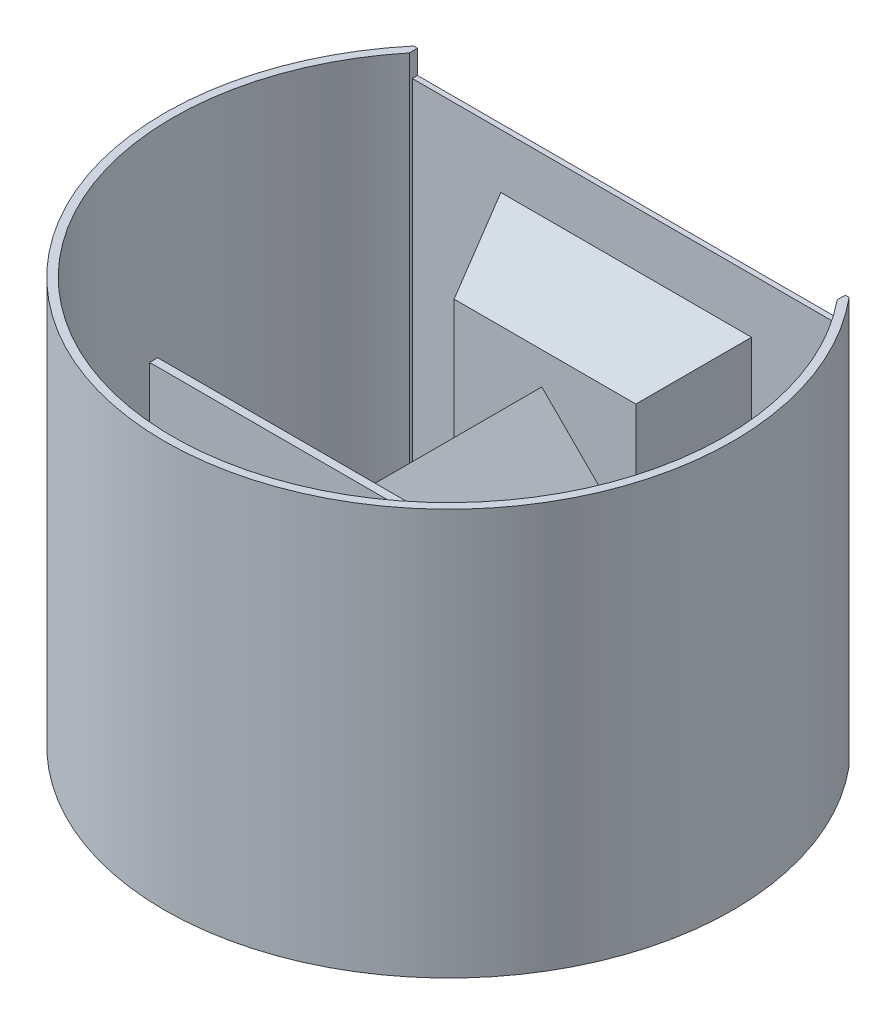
SolidWorks part; units mm, degrees
ref_plane "Alzado" through (0, 0, 0) normal (0, 0, 1) x (1, 0, 0)
ref_plane "Planta" through (0, 0, 0) normal (0, 1, 0) x (1, 0, 0)
ref_plane "Vista lateral" through (0, 0, 0) normal (1, 0, 0) x (0, 0, -1)
sketch "Croquis1" plane through (0, 0, 0) normal (0, 1, 0) x (1, 0, 0)
  line L1 (-53.619, 45) -> (-52.6783, 45)
  line L2 (-52.6783, 43) -> (-52.6783, 45)
  line L3 (52.6783, 43) -> (52.6783, 45)
  line L4 (52.6783, 45) -> (53.619, 45)
  line L5 (-53.619, 45) -> (53.619, 45) construction
  line L6 (-52.6783, 43) -> (52.6783, 43) construction
  arc A0 (-53.619, 45) -> (53.619, 45) centre (0, 0) ccw
  arc A1 (-52.6783, 43) -> (52.6783, 43) centre (0, 0) ccw
  point P8 (0, 45)
  dimension "D1" = 140
  dimension "D2" = 2
extrude "Saliente-Extruir1" add sketch "Croquis1" along normal blind 100
sketch "Croquis2" plane through (-52.6783, 0, 0) normal (1, 0, 0) x (0, 0, -1)
  line L0 (45, 100) -> (45, 0) construction
  line L1 (43.7174, 5.8136) -> (45, 5.8136)
  line L2 (43.7174, 5.8136) -> (43.7174, 94.1864)
  line L3 (43.7174, 94.1864) -> (45, 94.1864)
  line L5 (43.7174, 5.8136) -> (45, 50) construction
  line L6 (43.7174, 94.1864) -> (45, 50) construction
  line L7 (45, 94.1864) -> (45, 5.8136)
  point P0 (45, 50)
extrude "Saliente-Extruir2" add sketch "Croquis2" along normal blind 106
sketch "Croquis3" plane through (0, 0, -43.7174) normal (0, 0, 1) x (1, 0, 0)
  line L1 (-30.872, 19.2337) -> (30.872, 19.2337)
  line L2 (-30.872, 19.2337) -> (-30.872, 80.7663)
  line L3 (-30.872, 80.7663) -> (30.872, 80.7663)
  line L4 (30.872, 19.2337) -> (30.872, 80.7663)
  line L5 (-30.872, 19.2337) -> (30.872, 80.7663) construction
  line L6 (-30.872, 80.7663) -> (30.872, 19.2337) construction
  point P0 (0, 50)
extrude "Saliente-Extruir3" add sketch "Croquis3" along normal blind 20 draft 23
sketch "Croquis4" plane through (0, 0, -23.7174) normal (0, 0, 1) x (1, 0, 0)
  line L0 (-15.7849, 49.3358) -> (-0.7849, 64.3358)
  line L5 (-8.2849, 41.8358) -> (6.7151, 56.8358) construction
  line L6 (-8.2849, 56.8358) -> (6.7151, 41.8358) construction
  line L7 (-0.7849, 64.3358) -> (14.2151, 49.3358)
  line L8 (14.2151, 49.3358) -> (-0.7849, 34.3358)
  line L9 (-0.7849, 34.3358) -> (-15.7849, 49.3358)
  point P0 (-0.7849, 49.3358)
extrude "Saliente-Extruir4" add sketch "Croquis4" along normal blind 61
sketch "Croquis5" plane through (0, 0, 37.2826) normal (0, 0, 1) x (1, 0, 0)
  line L0 (34.3825, 15.7232) -> (34.3825, 84.2768)
  line L1 (34.3825, 84.2768) -> (-34.3825, 84.2768)
  line L2 (-34.3825, 84.2768) -> (-34.3825, 15.7232)
  line L3 (-34.3825, 15.7232) -> (34.3825, 15.7232)
extrude "Saliente-Extruir5" add sketch "Croquis5" along normal blind 2
